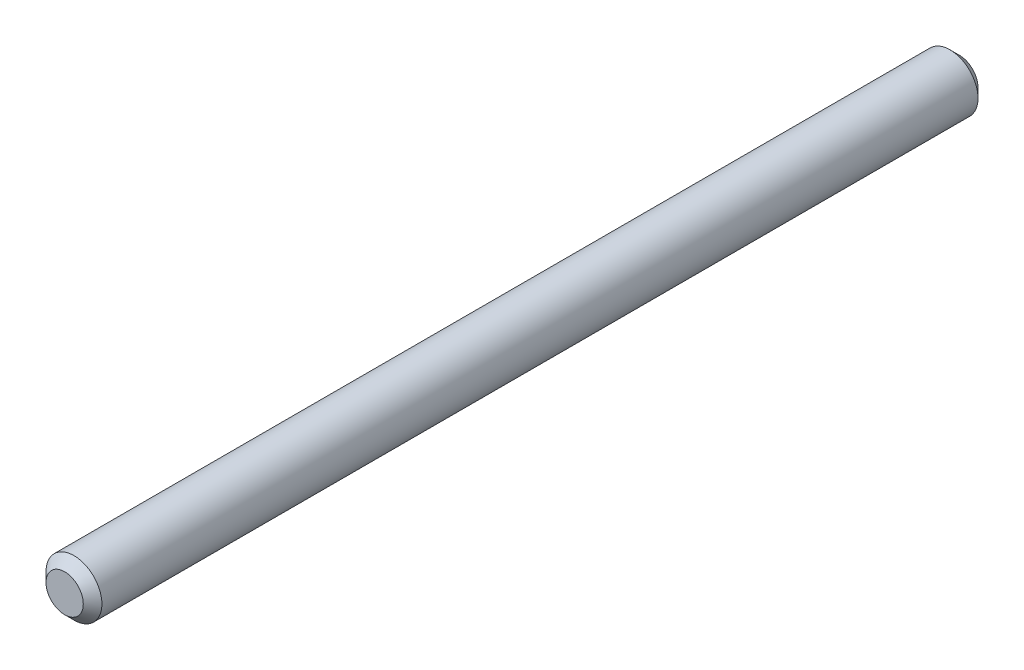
SolidWorks part; units mm, degrees
ref_plane "Plan de face" through (0, 0, 0) normal (0, 0, 1) x (1, 0, 0)
ref_plane "Plan de dessus" through (0, 0, 0) normal (0, 1, 0) x (1, 0, 0)
ref_plane "Plan de droite" through (0, 0, 0) normal (1, 0, 0) x (0, 0, -1)
sketch "Esquisse1" plane through (0, 0, 0) normal (0, 0, 1) x (1, 0, 0)
  circle A0 centre (0, 0) radius 1.5
extrude "Extrusion1" add sketch "Esquisse1" along normal blind 48
chamfer "Chanfrein1" distance 0.5 angle 45 2 edges at (1.5, 0, 0) (1.5, 0, 48)
